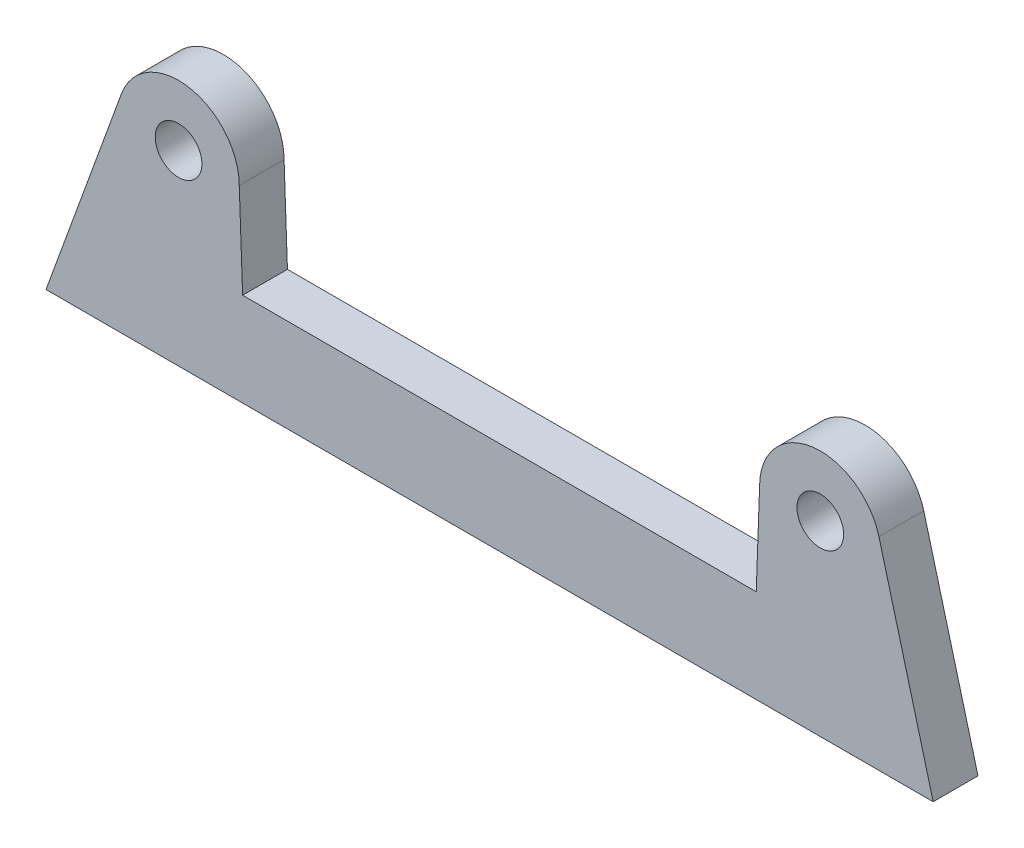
SolidWorks part; units mm, degrees
other "<Ground>-<Extrude1>"
ref_plane "Front Plane" through (0, 0, 0) normal (0, 0, 1) x (1, 0, 0)
ref_plane "Top Plane" through (0, 0, 0) normal (0, 1, 0) x (1, 0, 0)
ref_plane "Right Plane" through (0, 0, 0) normal (1, 0, 0) x (0, 0, -1)
mirrored part "Ground_Mirrored"
sketch3d "3DSketch1"
  circle A1 centre (18.0266, 25.3918, -1154.2104) radius 3.175 construction
  circle A2 centre (105.3001, 25.3918, -1154.2104) radius 3.175 construction
  circle A3 centre (18.0266, 25.3918, -1160.3064) radius 3.175 construction
  circle A4 centre (105.3001, 25.3918, -1160.3064) radius 3.175 construction
  point P0 (18.0266, 25.3918, -1154.2104)
  point P1 (18.0266, 25.3918, -1160.3064)
  point P2 (105.3001, 25.3918, -1160.3064)
  point P3 (105.3001, 25.3918, -1154.2104)
  point P6 (18.0266, 25.3918, -1151.0354)
  point P9 (105.3001, 25.3918, -1151.0354)
  point P12 (18.0266, 25.3918, -1157.1314)
  point P15 (105.3001, 25.3918, -1157.1314)
